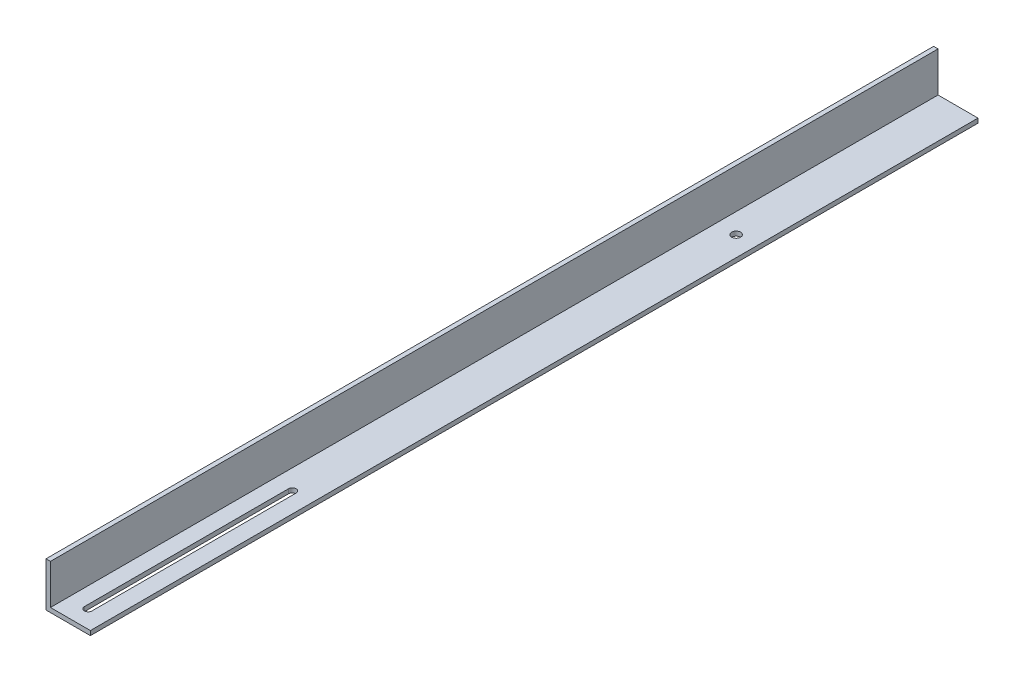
SolidWorks part; units mm, degrees
ref_plane "Ebene vorne" through (0, 0, 0) normal (0, 0, 1) x (1, 0, 0)
ref_plane "Ebene oben" through (0, 0, 0) normal (0, 1, 0) x (1, 0, 0)
ref_plane "Ebene rechts" through (0, 0, 0) normal (1, 0, 0) x (0, 0, -1)
sketch "Skizze1" plane through (0, 0, 0) normal (0, 0, 1) x (1, 0, 0)
  line L0 (0, 0) -> (0, 50)
  line L1 (0, 50) -> (5, 50)
  line L2 (5, 50) -> (5, 5)
  line L3 (5, 5) -> (50, 5)
  line L4 (50, 5) -> (50, 0)
  line L5 (50, 0) -> (0, 0)
  dimension "D1" = 50
  dimension "D2" = 50
  dimension "D3" = 45
  dimension "D4" = 45
extrude "Aufsatz-Linear austragen1" add sketch "Skizze1" against normal blind 1000
hole_wizard "Ø10.0 (10) Durchmesser Bohrung1" positions "Skizze3" profile "Skizze2" hole size "Ø10.0" standard "DIN"
sketch "Skizze3" plane through (0, 5, 0) normal (0, 1, 0) x (-1, 0, 0)
  line L0 (-50, -1000) -> (-5, -1000) construction
  line L1 (-50, -1000) -> (-50, 0) construction
  point P0 (-27.5, -750)
  dimension "D1" = 250
  dimension "D2" = 22.5
sketch "Skizze2" plane through (27.5, 5, -750) normal (1, 0, 0) x (0, 0, 1)
  line L0 (0, 0) -> (0, 5)
  line L1 (0, 5) -> (5, 5)
  line L2 (5, 5) -> (5, 0)
  line L5 (5, 0) -> (0, 0)
  line L11 (0, -6.35) -> (0, 107.95) construction
  dimension "Bohrerdurchmesser" = 10
  dimension "Bohrungstiefe" = 5
sketch "Skizze6" plane through (0, 5, 0) normal (0, 1, 0) x (1, 0, 0)
  line L0 (27.5, 20) -> (27.5, 250) construction
  line L1 (23.25, 20) -> (23.25, 250)
  line L2 (31.75, 20) -> (31.75, 250)
  line L3 (50, 1000) -> (50, 0) construction
  line L4 (50, 0) -> (5, 0) construction
  arc A0 (23.25, 20) -> (31.75, 20) centre (27.5, 20) ccw
  arc A1 (31.75, 250) -> (23.25, 250) centre (27.5, 250) ccw
  point P2 (27.5, 135)
  dimension "D1" = 8.5
  dimension "D2" = 22.5
  dimension "D3" = 20
  dimension "D4" = 230
extrude "Schnitt-Linear austragen1" cut sketch "Skizze6" against normal up to next
sketch "Skizze7" plane through (0, 0, 0) normal (0, 1, 0) x (1, 0, 0)
  spline S0 degree 1 poles (27.5, 250) (27.5, 20) knots 0 0 1 1
  point P2 (27.5, 750)
